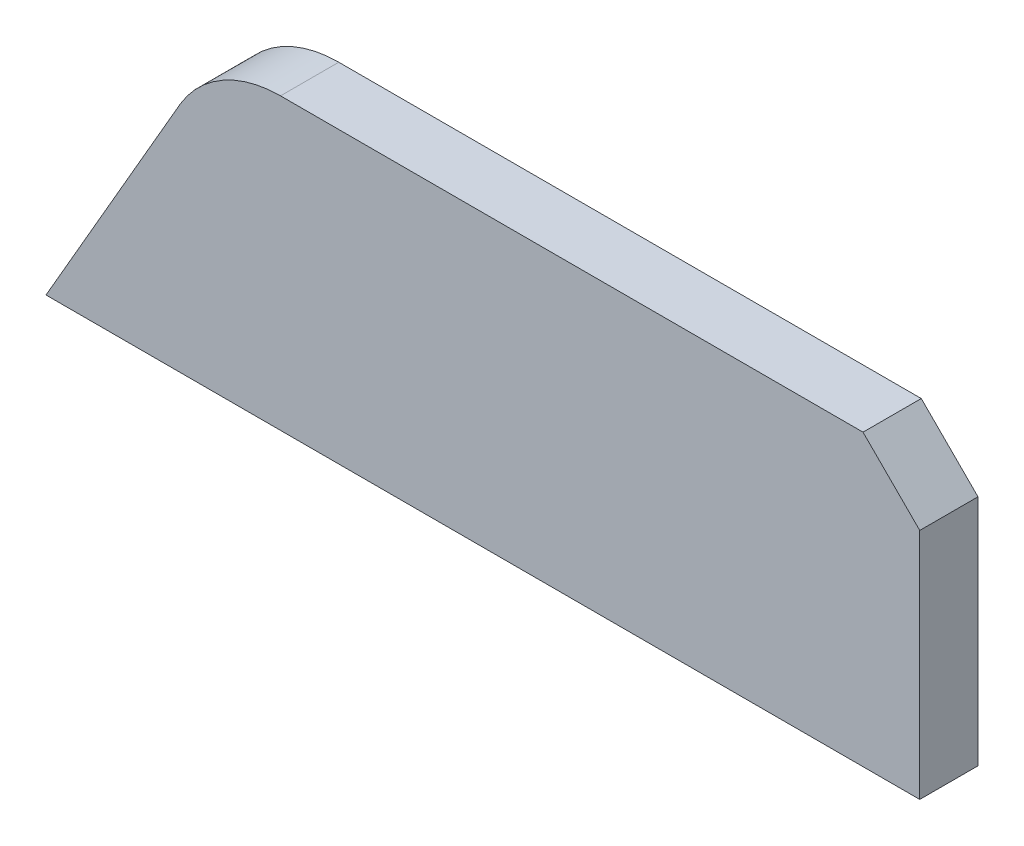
SolidWorks part; units mm, degrees
ref_plane "Front Plane" through (0, 0, 0) normal (0, 0, 1) x (1, 0, 0)
ref_plane "Top Plane" through (0, 0, 0) normal (0, 1, 0) x (1, 0, 0)
ref_plane "Right Plane" through (0, 0, 0) normal (1, 0, 0) x (0, 0, -1)
sketch "Sketch3" plane through (0, 0, 0) normal (0, 0, 1) x (1, 0, 0)
  line L0 (0, 0) -> (0, 40)
  line L1 (0, 40) -> (-9.7389, 49.7389)
  line L2 (-9.7389, 49.7389) -> (-109.7389, 49.7389)
  line L3 (-126.906, 40) -> (-150, 0)
  line L4 (-150, 0) -> (0, 0)
  line L5 (-118.2901, 34.9232) -> (-132.6795, 10)
  line L6 (-132.6795, 10) -> (-10, 10)
  line L7 (-10, 10) -> (-10, 35.8579)
  line L8 (-10, 35.8579) -> (-13.881, 39.7389)
  line L9 (-13.881, 39.7389) -> (-109.7389, 39.7389)
  arc A0 (-109.7389, 49.7389) -> (-126.906, 40) centre (-109.7389, 29.7389) ccw
  arc A1 (-109.7389, 39.7389) -> (-118.2901, 34.9232) centre (-109.7389, 29.7389) ccw
  dimension "D3" = 20
  dimension "D1" = 150
  dimension "D2" = 60
  dimension "D4" = 100
  dimension "D5" = 40
  dimension "D6" = 135
  dimension "D7" = 10
extrude "Boss-Extrude1" add sketch "Sketch3" along normal blind 10 contours L4 L0 L1 L2 A0 L3
